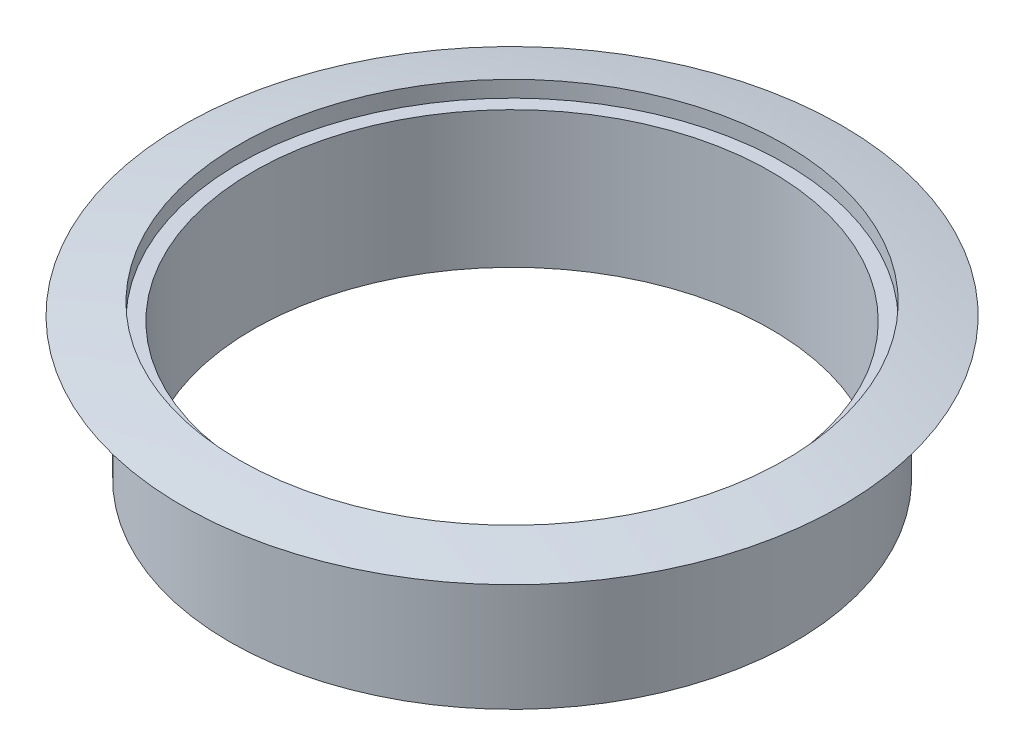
SolidWorks part; units mm, degrees
ref_plane "Front Plane" through (0, 0, 0) normal (0, 0, 1) x (1, 0, 0)
ref_plane "Top Plane" through (0, 0, 0) normal (0, 1, 0) x (1, 0, 0)
ref_plane "Right Plane" through (0, 0, 0) normal (1, 0, 0) x (0, 0, -1)
sketch "Sketch1" plane through (0, 0, 0) normal (0, 1, 0) x (1, 0, 0)
  circle A0 centre (0, 0) radius 30
  circle A1 centre (0, 0) radius 27.5
  dimension "D1" = 60
  dimension "D2" = 55
extrude "Boss-Extrude1" add sketch "Sketch1" against normal blind 15
sketch "Sketch2" plane through (0, 0, 0) normal (1, 0, 0) x (0, 0, -1)
  line L0 (-27.5, 0) -> (-35, 0)
  line L1 (30, 0) -> (-30, 0) construction
  line L2 (0, 0) -> (0, 9.5489) construction
  line L5 (0, 4) -> (12.4468, 4) construction
  line L6 (-27.5, 0) -> (-27.5, 1.5)
  arc A0 (-35, 0) -> (-27.5, 1.5) centre (1.1245, -161.1226) cw
  dimension "D1" = 70
  dimension "D2" = 4
  dimension "D3" = 1.5
revolve "Revolve1" add sketch "Sketch2" angle 360 about L2
ref_plane "Plane1" through (0, 1.5, 0) normal (0, 1, 0) x (-1, 0, 0)
sketch "Sketch3" plane through (0, 1.5, 0) normal (0, 1, 0) x (-1, 0, 0)
  circle A0 centre (0, 0) radius 29
  dimension "D1" = 58
extrude "Cut-Extrude1" cut sketch "Sketch3" against normal blind 2
